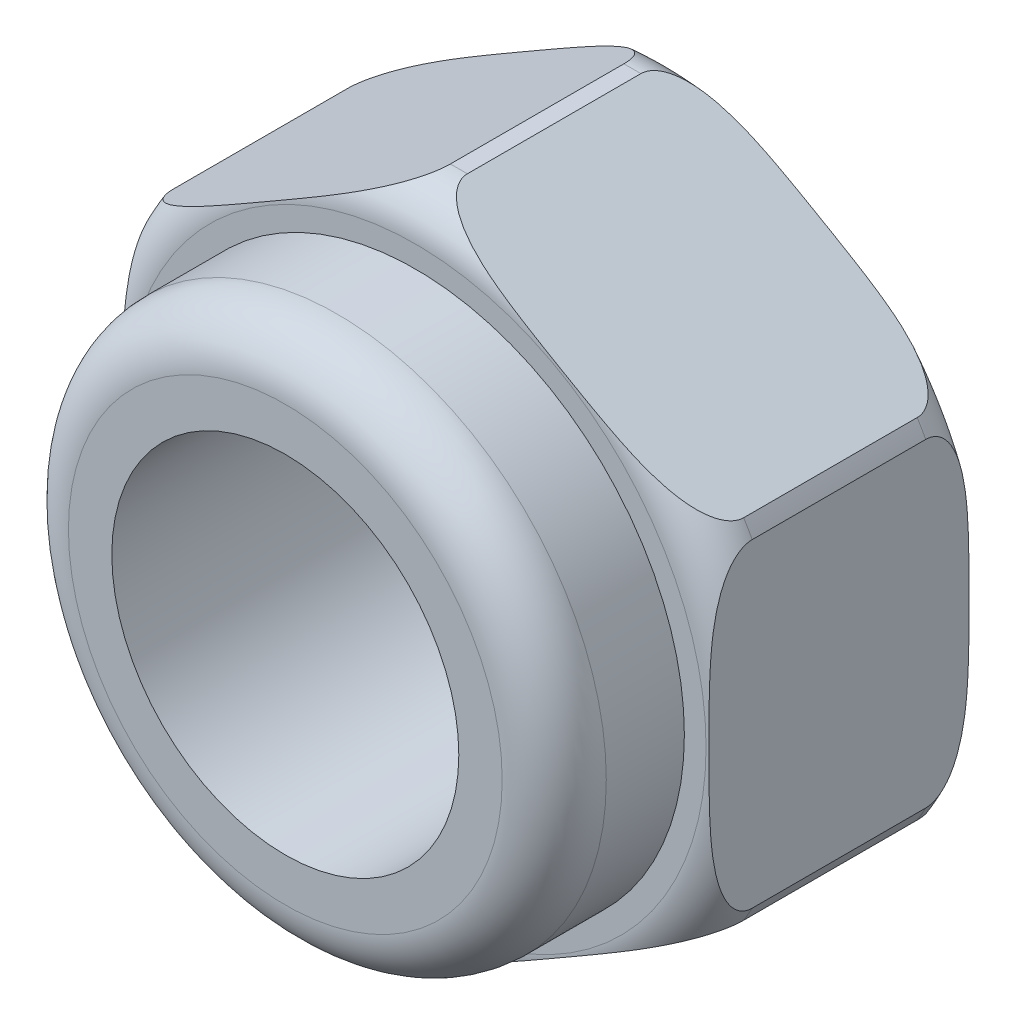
SolidWorks part; units mm, degrees
ref_plane "Plan de face" through (0, 0, 0) normal (0, 0, 1) x (1, 0, 0)
ref_plane "Plan de dessus" through (0, 0, 0) normal (0, 1, 0) x (1, 0, 0)
ref_plane "Plan de droite" through (0, 0, 0) normal (1, 0, 0) x (0, 0, -1)
sketch "Esquisse1" plane through (0, 0, 0) normal (0, 0, 1) x (1, 0, 0)
  circle A0 centre (0, 0) radius 3.85
  circle A1 centre (0, 0) radius 2
extrude "Extrusion1" add sketch "Esquisse1" along normal blind 3
fillet "Congé1" radius 0.5 2 edges at (3.85, 0, 0) (3.85, 0, 3)
sketch "Esquisse2" plane through (0, 0, 3) normal (0, 0, 1) x (1, 0, 0)
  line L3 (3.3821, 1.9527) -> (0, 3.9053)
  line L4 (0, 3.9053) -> (-3.3821, 1.9527)
  line L5 (-3.3821, 1.9527) -> (-3.3821, -1.9527)
  line L6 (-3.3821, -1.9527) -> (0, -3.9053)
  line L7 (0, -3.9053) -> (3.3821, -1.9527)
  line L8 (3.3821, -1.9527) -> (3.3821, 1.9527)
extrude "Enlèv. mat.-Extru.1" cut sketch "Esquisse2" against normal blind 3 flip side to cut
chamfer "Chanfrein1" distance 0.2 angle 45 1 edges at (2, 0, 0)
sketch "Esquisse3" plane through (0, 0, 3) normal (0, 0, 1) x (1, 0, 0)
  circle A0 centre (0, 0) radius 2
  circle A1 centre (0, 0) radius 3.1
extrude "Boss.-Extru.1" add sketch "Esquisse3" along normal blind 1.5
fillet "Congé2" radius 0.6 1 edges at (3.1, 0, 4.5)
